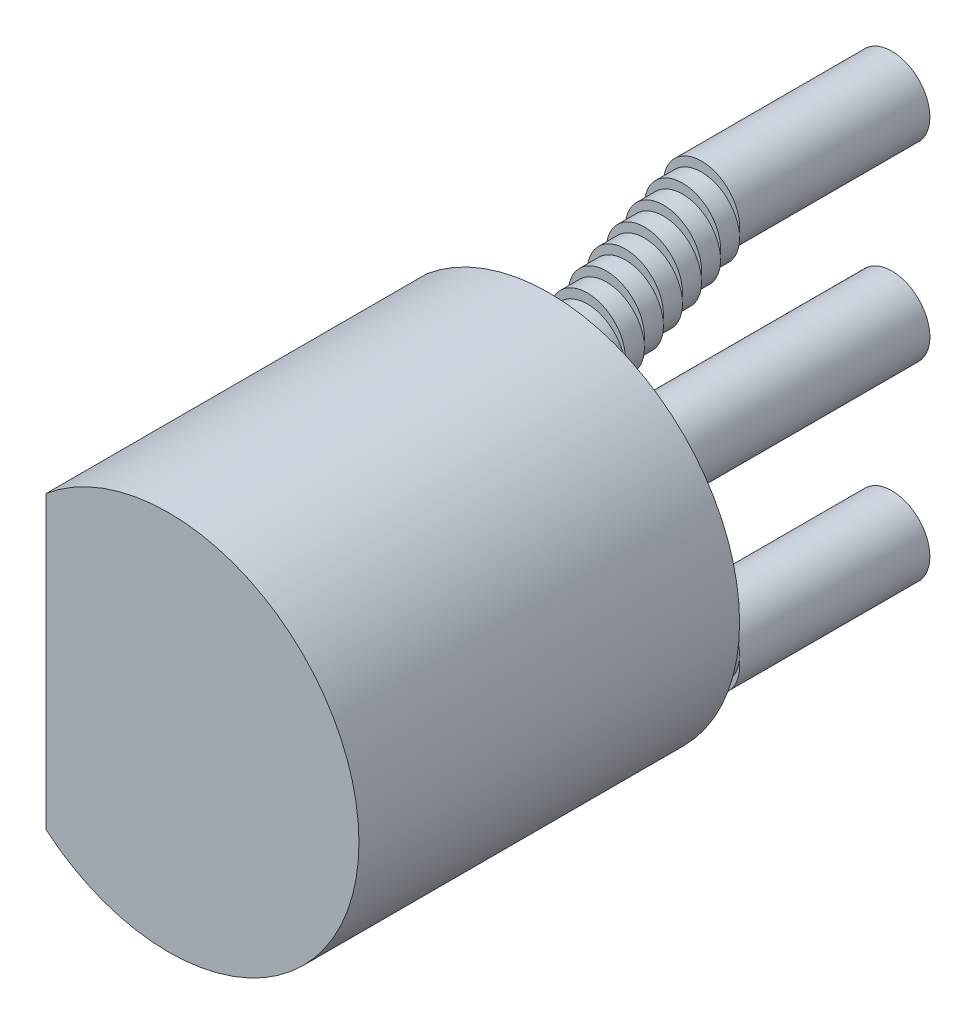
SolidWorks part; units mm, degrees
ref_plane "Front Plane" through (0, 0, 0) normal (0, 0, 1) x (1, 0, 0)
ref_plane "Top Plane" through (0, 0, 0) normal (0, 1, 0) x (1, 0, 0)
ref_plane "Right Plane" through (0, 0, 0) normal (1, 0, 0) x (0, 0, -1)
sketch "Sketch1" plane through (0, 0, 0) normal (0, 0, 1) x (1, 0, 0)
  line L1 (-1.6354, 1.9434) -> (-1.6354, -1.9434)
  arc A1 (-1.6354, 1.9434) -> (-1.6354, -1.9434) centre (0, 0) cw
extrude "Boss-Extrude1" add sketch "Sketch1" along normal blind 5.08
sketch "Sketch2" plane through (0, 0, 0) normal (0, 0, -1) x (-1, 0, 0)
  circle A0 centre (0, 0) radius 0.508
extrude "Boss-Extrude2" add sketch "Sketch2" along normal blind 4.572
sketch "Sketch3" plane through (0, 0, 0) normal (0, 0, -1) x (-1, 0, 0)
  circle A0 centre (0, 1.524) radius 0.508
  circle A1 centre (0, -1.524) radius 0.508
extrude "Boss-Extrude3" add sketch "Sketch3" along normal blind 0.254
sketch "Sketch4" plane through (0, 0, -0.254) normal (0, 0, -1) x (-1, 0, 0)
  circle A0 centre (0, 1.651) radius 0.508
  circle A1 centre (0, -1.651) radius 0.508
extrude "Boss-Extrude4" add sketch "Sketch4" along normal blind 0.254
sketch "Sketch5" plane through (0, 0, -0.508) normal (0, 0, -1) x (-1, 0, 0)
  circle A0 centre (0, 1.778) radius 0.508
  circle A1 centre (0, -1.778) radius 0.508
extrude "Boss-Extrude5" add sketch "Sketch5" along normal blind 0.254
sketch "Sketch6" plane through (0, 0, -0.762) normal (0, 0, -1) x (-1, 0, 0)
  circle A0 centre (0, 1.905) radius 0.508
  circle A1 centre (0, -1.905) radius 0.508
extrude "Boss-Extrude6" add sketch "Sketch6" along normal blind 0.254
sketch "Sketch7" plane through (0, 0, -1.016) normal (0, 0, -1) x (-1, 0, 0)
  circle A0 centre (0, 2.032) radius 0.508
  circle A1 centre (0, -2.032) radius 0.508
extrude "Boss-Extrude7" add sketch "Sketch7" along normal blind 0.254
sketch "Sketch8" plane through (0, 0, -1.27) normal (0, 0, -1) x (-1, 0, 0)
  circle A0 centre (0, 2.159) radius 0.508
  circle A1 centre (0, -2.159) radius 0.508
extrude "Boss-Extrude8" add sketch "Sketch8" along normal blind 0.254
sketch "Sketch9" plane through (0, 0, -1.524) normal (0, 0, -1) x (-1, 0, 0)
  circle A0 centre (0, 2.286) radius 0.508
  circle A1 centre (0, -2.286) radius 0.508
extrude "Boss-Extrude9" add sketch "Sketch9" along normal blind 0.254
sketch "Sketch10" plane through (0, 0, -1.778) normal (0, 0, -1) x (-1, 0, 0)
  circle A0 centre (0, 2.413) radius 0.508
  circle A1 centre (0, -2.413) radius 0.508
extrude "Boss-Extrude10" add sketch "Sketch10" along normal blind 0.254
sketch "Sketch11" plane through (0, 0, -2.032) normal (0, 0, -1) x (-1, 0, 0)
  circle A0 centre (0, 2.54) radius 0.508
  circle A1 centre (0, -2.54) radius 0.508
extrude "Boss-Extrude11" add sketch "Sketch11" along normal blind 2.54
